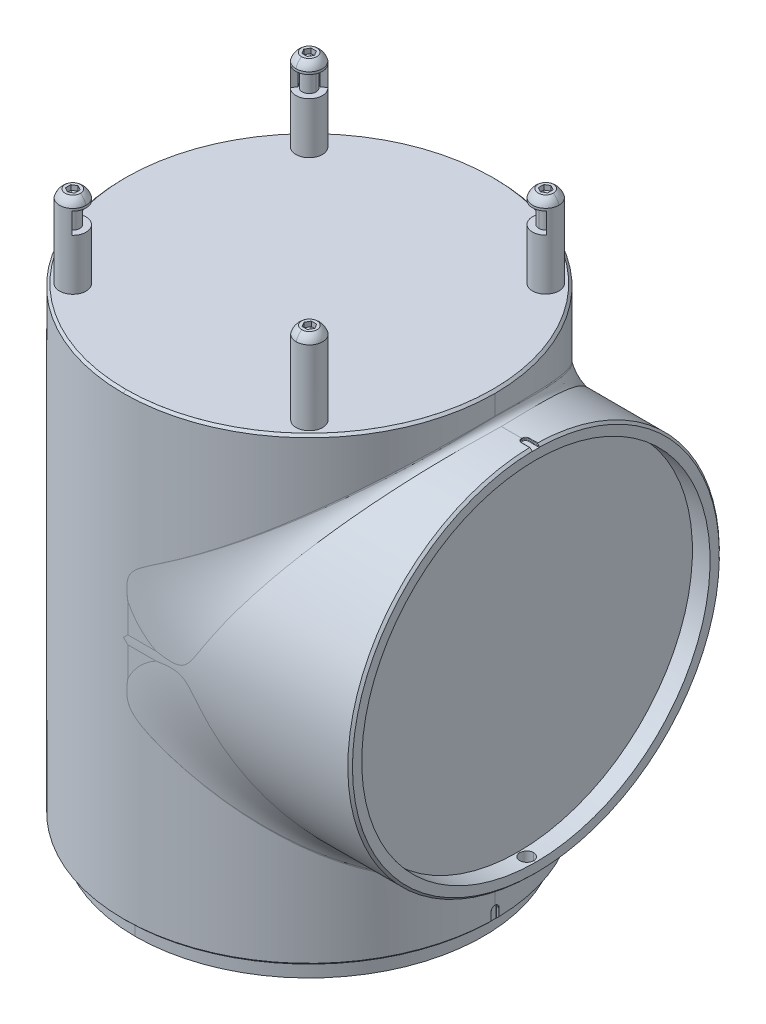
SolidWorks part; units mm, degrees
ref_plane "前视基准面" through (0, 0, 0) normal (0, 0, 1) x (1, 0, 0)
ref_plane "上视基准面" through (0, 0, 0) normal (0, 1, 0) x (1, 0, 0)
ref_plane "右视基准面" through (0, 0, 0) normal (1, 0, 0) x (0, 0, -1)
imported_body "14关节1.STEP"
sketch "草图2" plane through (45, 0, 0) normal (1, 0, 0) x (0, 0, -1)
  circle A0 centre (0, 40.2) radius 37.5
extrude "凸台-拉伸1" add sketch "草图2" against normal blind 40
ref_plane "基准面2" through (0, 120, 0) normal (0, 1, 0) x (1, 0, 0)
sketch "草图3" plane through (0, 120, 0) normal (0, 1, 0) x (1, 0, 0)
  circle A0 centre (0, 0) radius 64.8751
  circle A1 centre (-25.4707, 25.441) radius 2.85
  circle A2 centre (25.441, 25.4707) radius 2.85
  circle A3 centre (25.4707, -25.441) radius 2.85
  circle A4 centre (-25.441, -25.4707) radius 2.85
extrude "切除-拉伸1" cut sketch "草图3" against normal up to surface (33.8 mm away)
